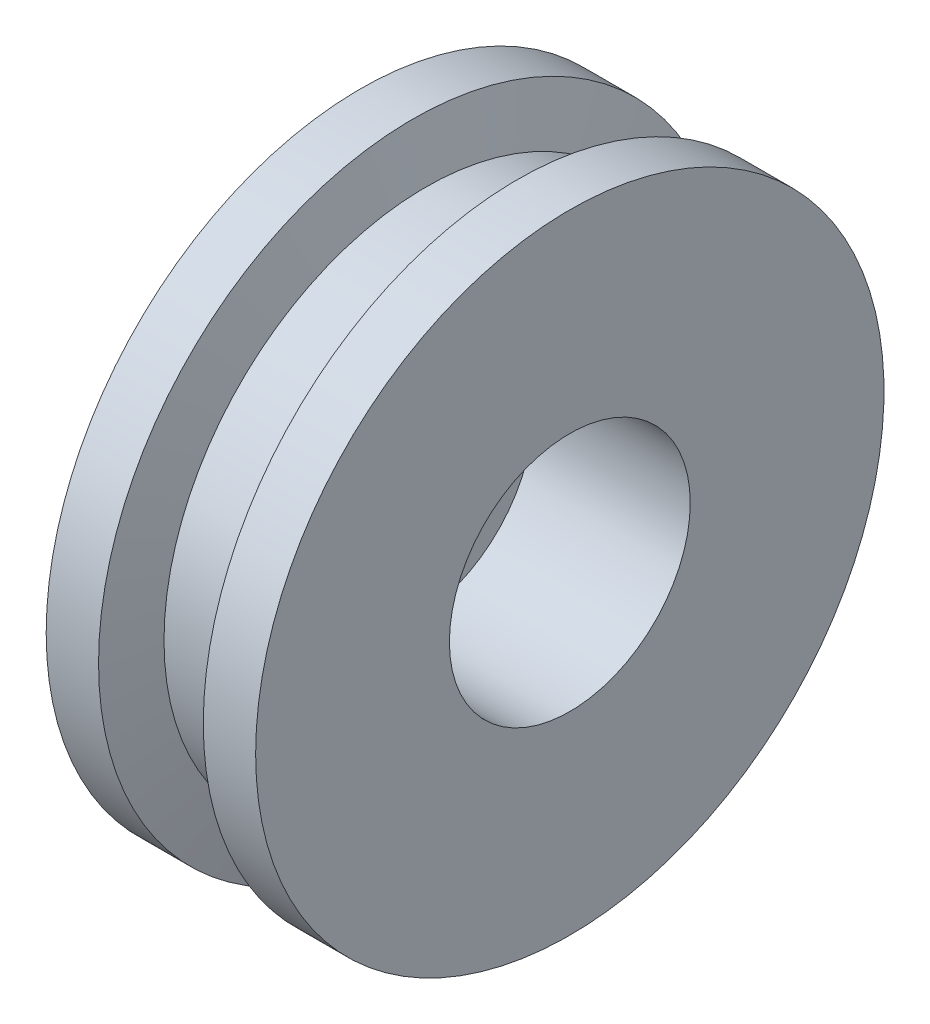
SolidWorks part; units mm, degrees
ref_plane "Plan de face" through (0, 0, 0) normal (0, 0, 1) x (1, 0, 0)
ref_plane "Plan de dessus" through (0, 0, 0) normal (0, 1, 0) x (1, 0, 0)
ref_plane "Plan de droite" through (0, 0, 0) normal (1, 0, 0) x (0, 0, -1)
sketch "Esquisse1" plane through (0, 0, 0) normal (0, 0, 1) x (1, 0, 0)
  line L0 (-12.9633, 0) -> (9.3269, 0) construction
  line L1 (-2, 12) -> (-1.5, 10)
  line L2 (-4, 0) -> (4, 0)
  line L3 (-4, 0) -> (-4, 12)
  line L4 (-4, 12) -> (-2, 12)
  line L5 (4, 0) -> (4, 12)
  line L6 (-1.5, 10) -> (1.5, 10)
  line L7 (1.5, 10) -> (2, 12)
  line L8 (2, 12) -> (4, 12)
  point P15 (0, 10)
  point P18 (0, 0)
  dimension "D1" = 12
  dimension "D2" = 8
  dimension "D3" = 3
  dimension "D4" = 2
  dimension "D5" = 2
  dimension "D6" = 2
revolve "Révolution1" add sketch "Esquisse1" angle 360 about L0
sketch "Esquisse2" plane through (-4, 0, 0) normal (-1, 0, 0) x (0, 0, 1)
  circle A0 centre (0, 0) radius 9.6
  dimension "D1" = 19.2
sketch "Esquisse3" plane through (4, 0, 0) normal (1, 0, 0) x (0, 0, -1)
  circle A0 centre (0, 0) radius 4.6
  dimension "D1" = 9.2
extrude "Enlèv. mat.-Extru.2" cut sketch "Esquisse3" against normal blind 6
sketch "Esquisse4" plane through (-4, 0, 0) normal (-1, 0, 0) x (0, 0, 1)
sketch "Esquisse5" plane through (-4, 0, 0) normal (-1, 0, 0) x (0, 0, 1)
  circle A0 centre (-0.0009, 0) radius 3
  point P2 (0, 0)
  dimension "D1" = 6
extrude "Enlèv. mat.-Extru.3" cut sketch "Esquisse5" against normal blind 8
